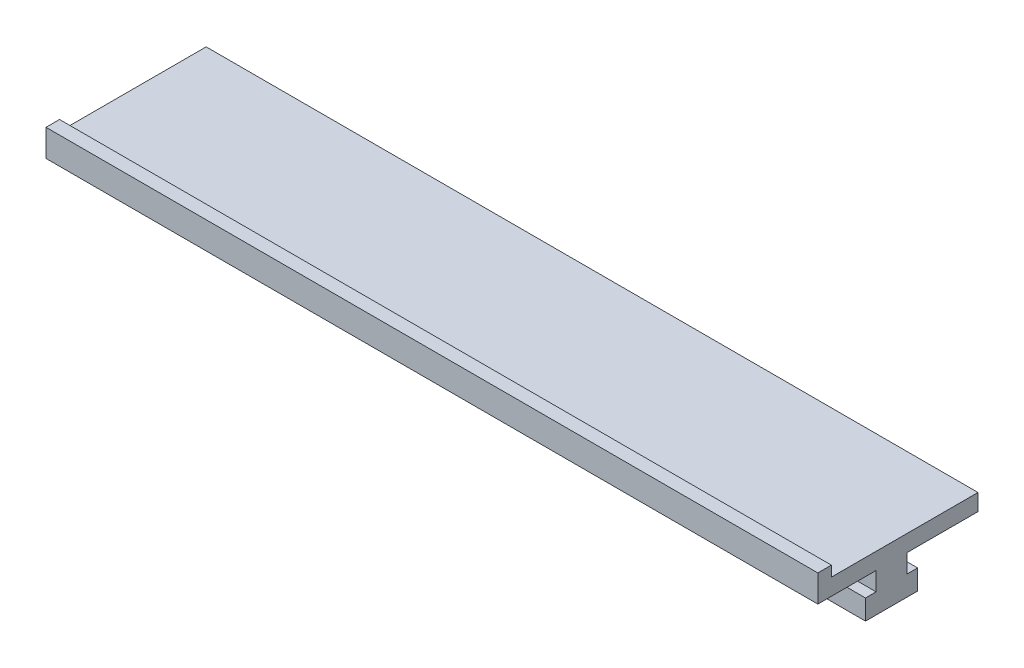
SolidWorks part; units mm, degrees
ref_plane "Front Plane" through (0, 0, 0) normal (0, 0, 1) x (1, 0, 0)
ref_plane "Top Plane" through (0, 0, 0) normal (0, 1, 0) x (1, 0, 0)
ref_plane "Right Plane" through (0, 0, 0) normal (1, 0, 0) x (0, 0, -1)
sketch3d "3DSketch1"
  line L0 (0, 0, 0) -> (200, 0, 0)
  dimension "D1" = 200
other "Liukukiskot hihnalle 1.6050 LIUKUKISKO 75(1)"
ref_plane "Plane1" through (0, 0, 0) normal (1, 0, 0) x (0, 0, -1)
sketch "Sketch1" plane through (0, 0, 0) normal (1, 0, 0) x (0, 0, -1)
  line L0 (22.6328, 4.6321) -> (-15.3672, 4.6321)
  line L1 (-18.8672, 7.3321) -> (-18.8672, 0.3321)
  line L2 (-18.8672, 0.3321) -> (-3.7672, 0.3321)
  line L3 (-3.7672, 0.3321) -> (-3.7672, -4.4679)
  line L4 (-3.7672, -4.4679) -> (-6.5172, -4.4679)
  line L5 (-6.5172, -4.4679) -> (-6.5172, -9.6679)
  line L6 (-6.5172, -9.6679) -> (6.9828, -9.6679)
  line L7 (6.9828, -9.6679) -> (6.9828, -4.4679)
  line L8 (6.9828, -4.4679) -> (4.2328, -4.4679)
  line L9 (4.2328, -4.4679) -> (4.2328, 0.3321)
  line L10 (4.2328, 0.3321) -> (22.6328, 0.3321)
  line L11 (22.6328, 0.3321) -> (22.6328, 4.6321)
  line L12 (-15.3672, 4.6321) -> (-15.3672, 7.3321)
  line L13 (-15.3672, 7.3321) -> (-18.8672, 7.3321)
  point P1 (0, 0)
  dimension "D1" = 3.5
  dimension "D2" = 5.2
  dimension "D3" = 13.5
  dimension "D4" = 4.8
  dimension "D5" = 18.4
  dimension "D6" = 8
  dimension "D7" = 2.75
  dimension "D8" = 15.1
  dimension "D9" = 4.3
  dimension "D10" = 2.7
